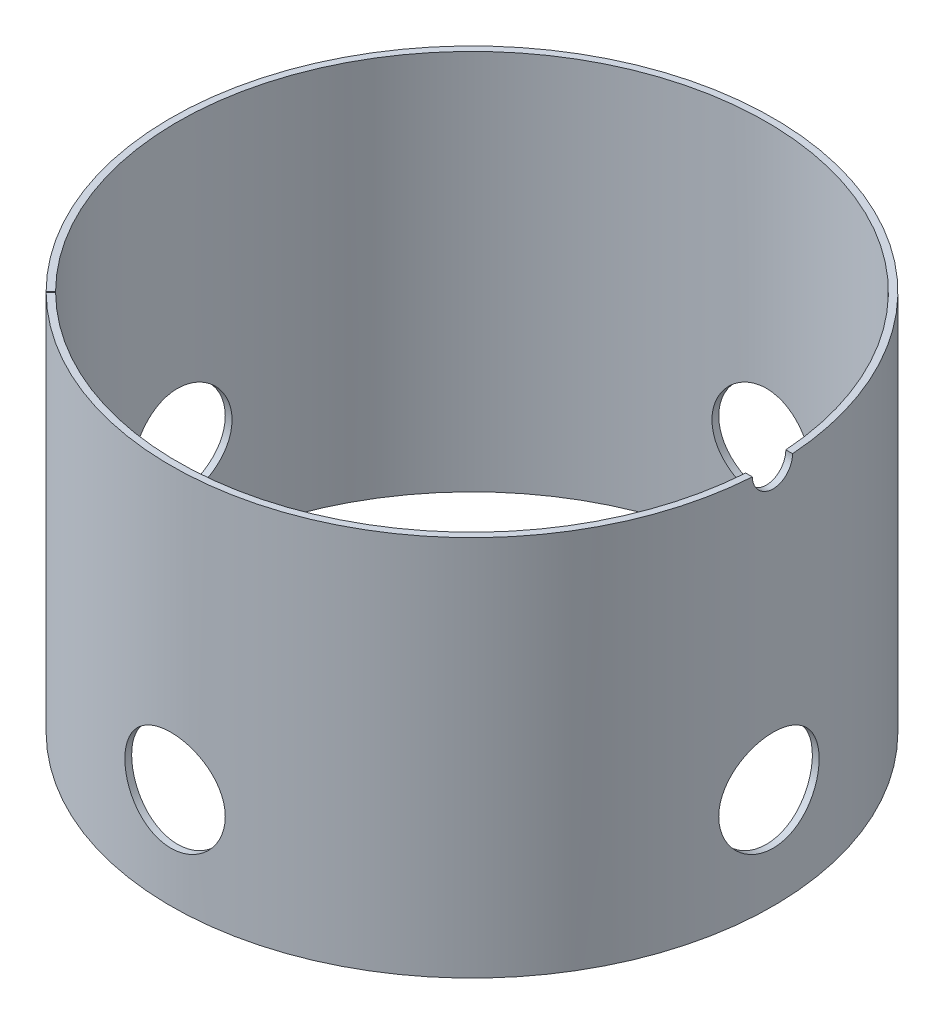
SolidWorks part; units mm, degrees
ref_plane "Plane1" through (0, 0, 0) normal (0, 0, 1) x (1, 0, 0)
ref_plane "Plane2" through (0, 0, 0) normal (0, 1, 0) x (1, 0, 0)
ref_plane "Plane3" through (0, 0, 0) normal (1, 0, 0) x (0, 0, -1)
sketch "Esquisse1" plane through (0, 0, 0) normal (0, 0, 1) x (1, 0, 0)
  line L0 (0, 0) -> (0, 80) construction
  line L1 (225, 0) -> (225, 285)
  line L2 (10, 0) -> (100, 40) construction
  dimension "D1" = 285
  dimension "D2" = 225
revolve "Base-Révol.-Mince" add sketch "Esquisse1" angle 360 about L0
ref_plane "Plan5" through (0, 0, 500) normal (0, 0, 1) x (1, 0, 0)
ref_plane "Plan6" through (500, 0, 0) normal (1, 0, 0) x (0, 0, -1)
sketch "Esquisse9" plane through (500, 0, 0) normal (1, 0, 0) x (0, 0, -1)
  circle A0 centre (0, 75) radius 37.5
  dimension "D1" = 75
extrude "Enlèv. mat.-Extru.7" cut sketch "Esquisse9" against normal through all
sketch "Esquisse10" plane through (500, 0, 0) normal (1, 0, 0) x (0, 0, -1)
  circle A0 centre (0, 285) radius 15
  dimension "D1" = 30
extrude "Enlèv. mat.-Extru.9" cut sketch "Esquisse10" against normal up to next
ref_plane "Plan7" through (0, 0, 550) normal (0, 0, 1) x (1, 0, 0)
sketch "Esquisse12" plane through (0, 0, 500) normal (0, 0, 1) x (1, 0, 0)
  line L0 (225, 0) -> (-225, 0) construction
  circle A0 centre (0, 75) radius 37.5
  dimension "D1" = 75
  dimension "D2" = 75
extrude "Enlèv. mat.-Extru.11" cut sketch "Esquisse12" against normal through all
sketch "Esquisse13" plane through (0, 285, 0) normal (0, 1, 0) x (1, 0, 0)
  line L0 (0, 0) -> (-181.1078, -181.1078) construction
  line L1 (0, 0) -> (-260.9241, 0) construction
  line L2 (-136.7384, -136.0313) -> (-198.862, -198.1549)
  line L3 (-198.862, -198.1549) -> (-198.1549, -198.862)
  line L4 (-198.1549, -198.862) -> (-136.0313, -136.7384)
  line L5 (-136.0313, -136.7384) -> (-136.7384, -136.0313)
  dimension "D1" = 45
  dimension "D2" = 0.5
  dimension "D3" = 1
extrude "Enlèv. mat.-Extru.12" cut sketch "Esquisse13" against normal through all
